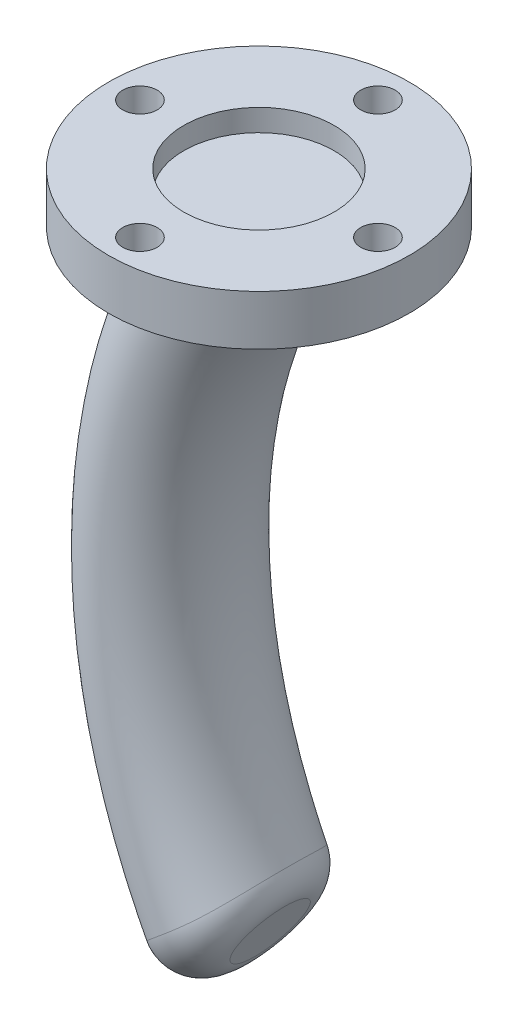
SolidWorks part; units mm, degrees
ref_plane "Front Plane" through (0, 0, 0) normal (0, 0, 1) x (1, 0, 0)
ref_plane "Top Plane" through (0, 0, 0) normal (0, 1, 0) x (1, 0, 0)
ref_plane "Right Plane" through (0, 0, 0) normal (1, 0, 0) x (0, 0, -1)
sketch "Sketch1" plane through (0, 0, 0) normal (0, 1, 0) x (1, 0, 0)
  circle A0 centre (0, 0) radius 24
  dimension "D1" = 48
extrude "Boss-Extrude1" add sketch "Sketch1" along normal blind 8
ref_plane "Plane1" through (0, -30, 0) normal (0, -1, 0) x (-1, 0, 0)
ref_plane "Plane2" through (0, -100, 0) normal (0, -1, 0) x (-1, 0, 0)
sketch "Sketch5" plane through (0, 0, 0) normal (0, -1, 0) x (1, 0, 0)
  circle A0 centre (0, 0) radius 12
  dimension "D1" = 24
sketch "Sketch6" plane through (0, -30, 0) normal (0, -1, 0) x (-1, 0, 0)
  circle A0 centre (12, 0) radius 12
  dimension "D1" = 24
  dimension "D2" = 12
sketch "Sketch7" plane through (0, -100, 0) normal (0, -1, 0) x (-1, 0, 0)
  circle A0 centre (0, 0) radius 12
sketch "Sketch8" plane through (0, 0, 0) normal (0, 0, 1) x (1, 0, 0)
  line L2 (-24, 0) -> (24, 0) construction
  line L3 (-12, -100) -> (12, -100) construction
  arc A0 (0, 0) -> (0, -100) centre (81.575, -50) ccw
sweep "Sweep1" add profiles "Sketch5" path "Sketch8"
fillet "Fillet4" radius 6 1 edges at (0, -100, -12)
sketch "Sketch10" plane through (0, 8, 0) normal (0, 1, 0) x (1, 0, 0)
  circle A0 centre (0, 0) radius 12
  dimension "D1" = 24
extrude "Cut-Extrude4" cut sketch "Sketch10" against normal blind 3.5
sketch "Sketch11" plane through (0, 8, 0) normal (0, 1, 0) x (1, 0, 0)
  circle A0 centre (19, 0) radius 2.75
  circle A1 centre (0, -19) radius 2.75
  circle A2 centre (-19, 0) radius 2.75
  circle A3 centre (0, 19) radius 2.75
  point P12 (0, 0)
  dimension "D2" = 5.5
  dimension "D1" = 19
  dimension "D3" = 4
extrude "Cut-Extrude5" cut sketch "Sketch11" against normal blind 5.5
